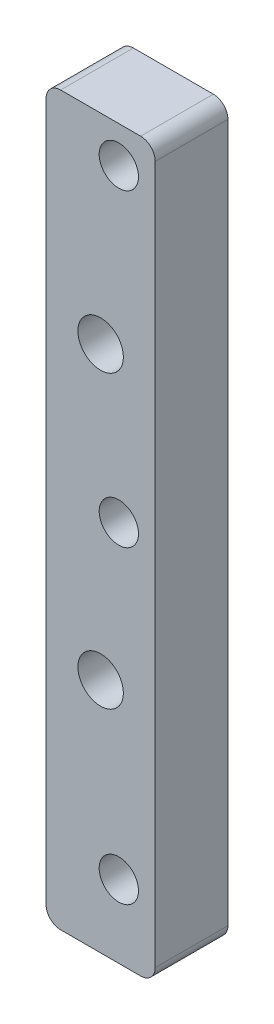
SolidWorks part; units mm, degrees
ref_plane "Front Plane" through (0, 0, 0) normal (0, 0, 1) x (1, 0, 0)
ref_plane "Top Plane" through (0, 0, 0) normal (0, 1, 0) x (1, 0, 0)
ref_plane "Right Plane" through (0, 0, 0) normal (1, 0, 0) x (0, 0, -1)
sketch "Sketch1" plane through (0, 0, 0) normal (0, 0, 1) x (1, 0, 0)
  line L1 (-7.6893, 54.7924) -> (11.3607, 54.7924)
  line L2 (-7.6893, 54.7924) -> (-7.6893, -72.2076)
  line L3 (-7.6893, -72.2076) -> (11.3607, -72.2076)
  line L4 (11.3607, 54.7924) -> (11.3607, -72.2076)
  dimension "D1" = 127
  dimension "D2" = 19.05
extrude "Boss-Extrude1" add sketch "Sketch1" along normal blind 12.7
sketch "Sketch2" plane through (0, 0, 12.7) normal (0, 0, 1) x (1, 0, 0)
  line L0 (11.3607, -72.2076) -> (11.3607, 54.7924) construction
  line L1 (5.0107, 54.7924) -> (5.0107, -72.2076) construction
  line L2 (11.3607, 54.7924) -> (-7.6893, 54.7924) construction
  line L3 (-7.6893, -72.2076) -> (11.3607, -72.2076) construction
  line L4 (-7.6893, -8.7076) -> (11.3607, -8.7076) construction
  line L5 (-7.6893, 54.7924) -> (-7.6893, -72.2076) construction
  circle A0 centre (5.0107, 48.4424) radius 3.429
  circle A1 centre (5.0107, -59.5076) radius 3.429
  circle A2 centre (5.0107, -5.5326) radius 3.429
  dimension "D5" = 6.858
  dimension "D6" = 6.858
  dimension "D7" = 6.858
  dimension "D1" = 6.35
  dimension "D2" = 6.35
  dimension "D3" = 12.7
  dimension "D4" = 3.175
extrude "Cut-Extrude1" cut sketch "Sketch2" against normal through all
sketch "Sketch3" plane through (0, 0, 12.7) normal (0, 0, 1) x (1, 0, 0)
  line L0 (11.3607, -72.2076) -> (11.3607, 54.7924) construction
  circle A0 centre (1.8357, 19.8674) radius 3.9688
  circle A1 centre (1.8357, -30.9326) radius 3.9688
  circle A2 centre (5.0107, -5.5326) radius 3.429 construction
  dimension "D1" = 25.4
  dimension "D2" = 25.4
  dimension "D4" = 7.9375
  dimension "D5" = 7.9375
  dimension "D3" = 9.525
extrude "Cut-Extrude2" cut sketch "Sketch3" against normal through all
fillet "Fillet1" radius 2.54 4 edges at (11.3607, -72.2076, 6.35) (-7.6893, -72.2076, 6.35) (11.3607, 54.7924, 6.35) (-7.6893, 54.7924, 6.35)
